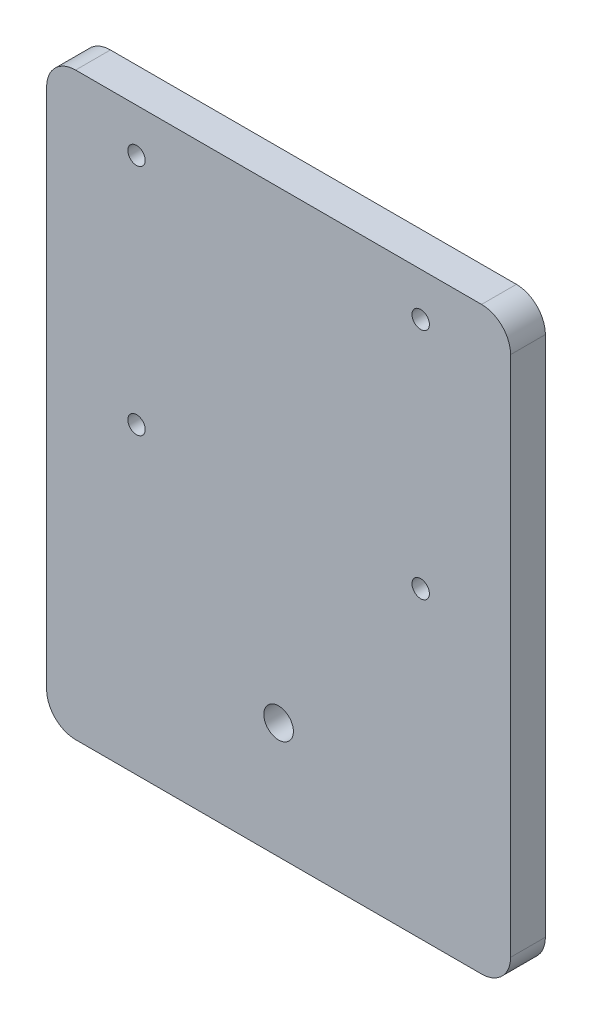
SolidWorks part; units mm, degrees
ref_plane "Front Plane" through (0, 0, 0) normal (0, 0, 1) x (1, 0, 0)
ref_plane "Top Plane" through (0, 0, 0) normal (0, 1, 0) x (1, 0, 0)
ref_plane "Right Plane" through (0, 0, 0) normal (1, 0, 0) x (0, 0, -1)
sketch "Sketch1" plane through (0, 0, 0) normal (0, 0, 1) x (1, 0, 0)
  line L1 (-40, -50) -> (40, -50)
  line L2 (-40, -50) -> (-40, 50)
  line L3 (-40, 50) -> (40, 50)
  line L4 (40, -50) -> (40, 50)
  line L5 (-40, -50) -> (40, 50) construction
  line L6 (-40, 50) -> (40, -50) construction
  point P0 (0, 0)
  dimension "D1" = 100
  dimension "D2" = 80
extrude "Boss-Extrude1" add sketch "Sketch1" along normal blind 6
fillet "Fillet1" radius 5 4 edges at (-40, 50, 3) (-40, -50, 3) (40, -50, 3) (40, 50, 3)
sketch "Sketch2" plane through (0, 0, 6) normal (0, 0, 1) x (1, 0, 0)
  line L0 (0, -2.3476) -> (0, -28.2071) construction
  line L1 (-35, -50) -> (35, -50) construction
  circle A0 centre (0, -30) radius 2.55
  dimension "D1" = 5.1
  dimension "D2" = 20
extrude "Cut-Extrude1" cut sketch "Sketch2" against normal blind 6
sketch "Sketch5" plane through (0, 0, 0) normal (0, 0, -1) x (-1, 0, 0)
  circle A0 centre (24.5, 2.2988) radius 1.5
  circle A1 centre (24.5, 42.5012) radius 1.5
  circle A2 centre (-24.5, 2.2988) radius 1.5
  circle A3 centre (-24.5, 42.5012) radius 1.5
extrude "Cut-Extrude2" cut sketch "Sketch5" against normal blind 10
